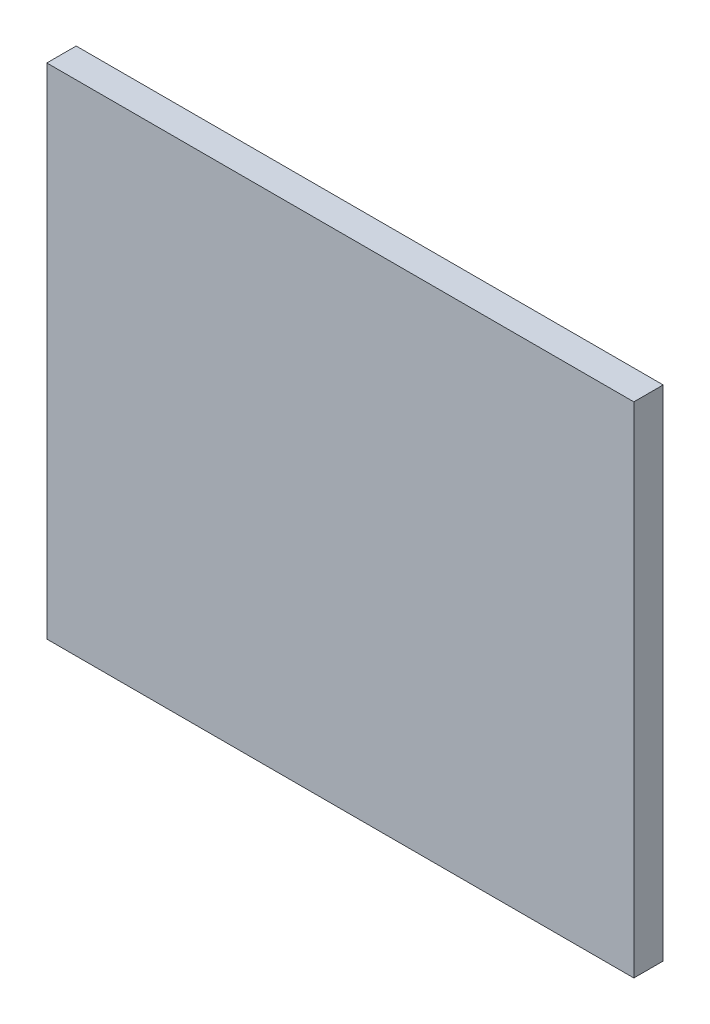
SolidWorks part; units mm, degrees
ref_plane "Front Plane" through (0, 0, 0) normal (0, 0, 1) x (1, 0, 0)
ref_plane "Top Plane" through (0, 0, 0) normal (0, 1, 0) x (1, 0, 0)
ref_plane "Right Plane" through (0, 0, 0) normal (1, 0, 0) x (0, 0, -1)
sketch "Sketch1" plane through (0, 0, 0) normal (0, 0, 1) x (1, 0, 0)
  line L1 (-1, 0.85) -> (1, 0.85)
  line L2 (-1, 0.85) -> (-1, -0.85)
  line L3 (-1, -0.85) -> (1, -0.85)
  line L4 (1, 0.85) -> (1, -0.85)
  line L5 (-1, 0.85) -> (1, -0.85) construction
  line L6 (-1, -0.85) -> (1, 0.85) construction
  point P0 (0, 0)
  dimension "D1" = 1.7
  dimension "D2" = 2
extrude "Boss-Extrude1" add sketch "Sketch1" along normal blind 0.1
